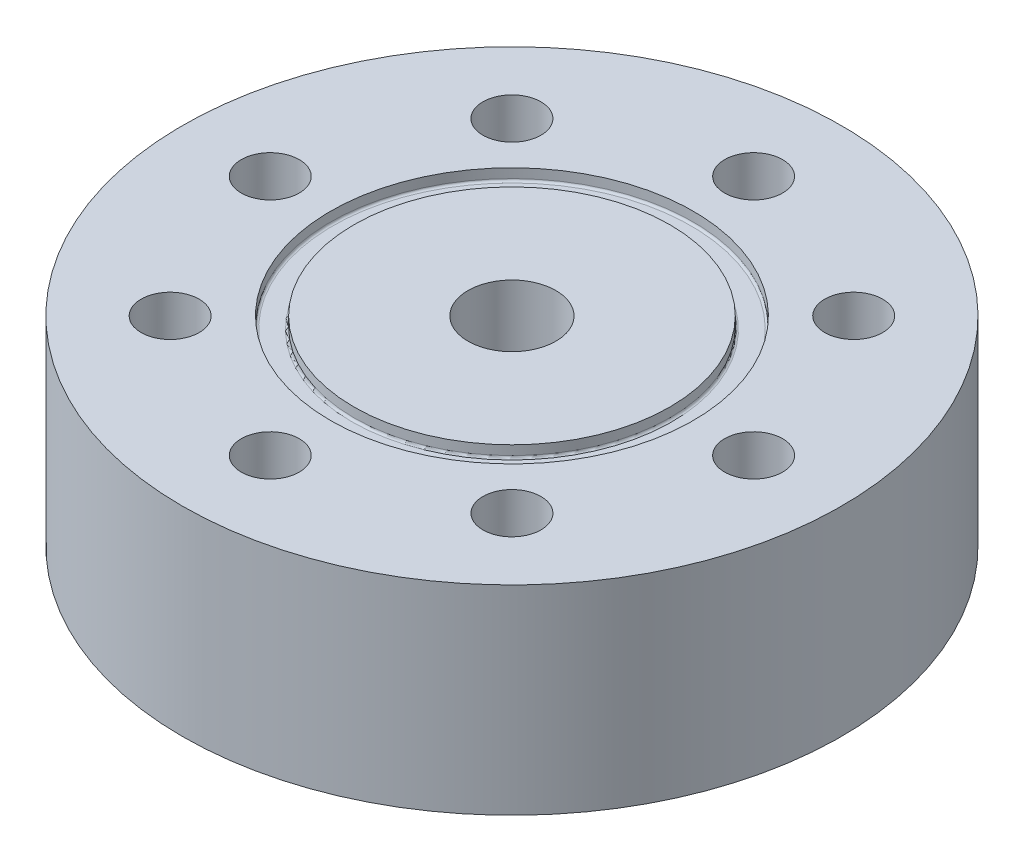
SolidWorks part; units mm, degrees
ref_plane "Front Plane" through (0, 0, 0) normal (0, 0, 1) x (1, 0, 0)
ref_plane "Top Plane" through (0, 0, 0) normal (0, 1, 0) x (1, 0, 0)
ref_plane "Right Plane" through (0, 0, 0) normal (1, 0, 0) x (0, 0, -1)
sketch "Sketch2" plane through (0, 0, 0) normal (0, 1, 0) x (1, 0, 0)
  circle A0 centre (0, 0) radius 37.5
  dimension "D1" = 75
extrude "Outer Cylinder" add sketch "Sketch2" along normal blind 22.7
sketch "Sketch3" plane through (0, 0, 0) normal (0, -1, 0) x (1, 0, 0)
  circle A0 centre (0, 0) radius 8.93
  dimension "D1" = 17.86
extrude "NPT Hole" cut sketch "Sketch3" against normal blind 12.7
sketch "Sketch4" plane through (0, 0, 0) normal (0, -1, 0) x (1, 0, 0)
  circle A0 centre (-27.5, 0) radius 3.3
  circle A1 centre (-19.4454, 19.4454) radius 3.3
  circle A2 centre (0, 27.5) radius 3.3
  circle A3 centre (19.4454, 19.4454) radius 3.3
  circle A4 centre (27.5, 0) radius 3.3
  circle A5 centre (19.4454, -19.4454) radius 3.3
  circle A6 centre (0, -27.5) radius 3.3
  circle A7 centre (-19.4454, -19.4454) radius 3.3
  point P19 (0, 0)
  dimension "D1" = 6.6
  dimension "D2" = 27.5
  dimension "D3" = 8
extrude "Bolt Holes" cut sketch "Sketch4" against normal through all
sketch "Sketch5" plane through (0, 22.7, 0) normal (0, 1, 0) x (1, 0, 0)
  circle A0 centre (0, 0) radius 17.9705
  circle A1 centre (0, 0) radius 20.6375
  dimension "D1" = 41.275
  dimension "D2" = 2.667
extrude "O-Ring Groove" cut sketch "Sketch5" against normal blind 1.3208
fillet "Fillet1" radius 0.254 2 edges at (0, 21.3792, 17.9705) (0, 21.3792, 20.6375)
sketch "Sketch6" plane through (0, 22.7, 0) normal (0, 1, 0) x (1, 0, 0)
  circle A0 centre (0, 0) radius 5
extrude "Inlet Flow Diameter" cut sketch "Sketch6" against normal blind 10
equation "\"D\"= 10"
equation "\"Inlet Flow Diameter\"= \"D\""
equation "\"D1@Sketch6\"=\"D\""
